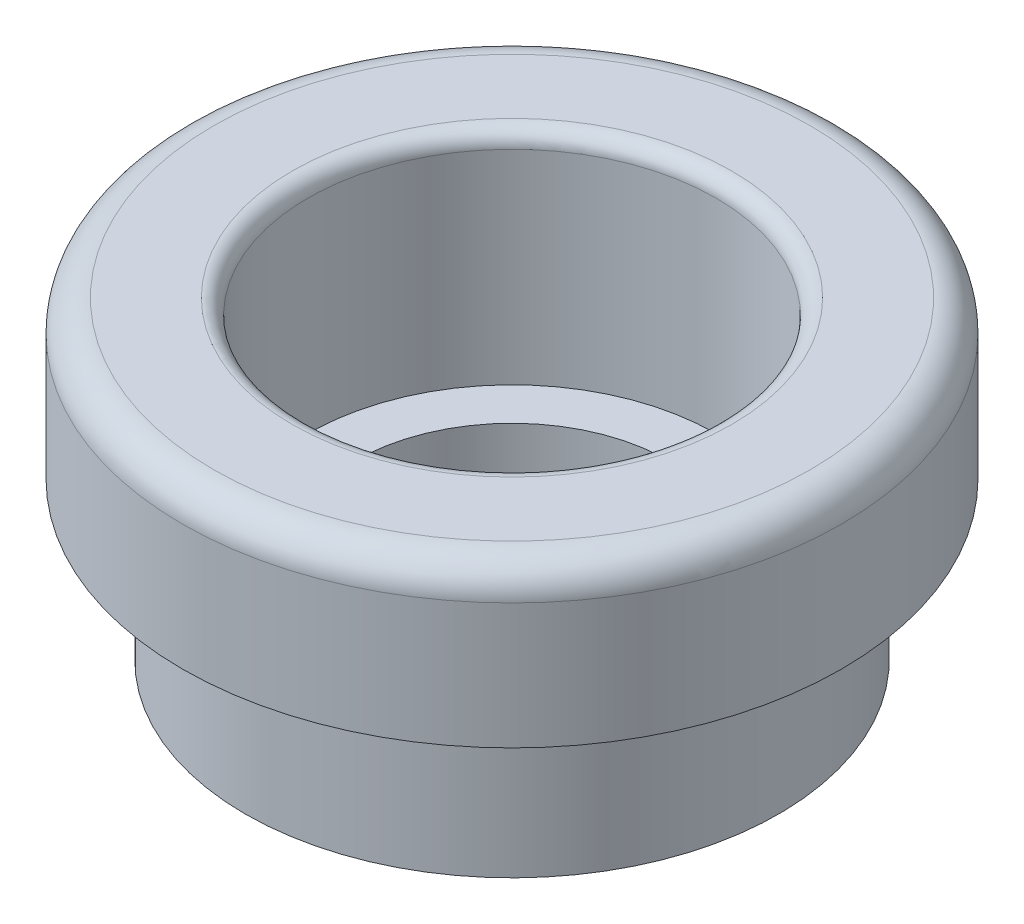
SolidWorks part; units mm, degrees
ref_plane "Front Plane" through (0, 0, 0) normal (0, 0, 1) x (1, 0, 0)
ref_plane "Top Plane" through (0, 0, 0) normal (0, 1, 0) x (1, 0, 0)
ref_plane "Right Plane" through (0, 0, 0) normal (1, 0, 0) x (0, 0, -1)
sketch "Sketch1" plane through (0, 0, 0) normal (0, 1, 0) x (1, 0, 0)
  circle A0 centre (0, 0) radius 8.5
  dimension "D1" = 17
extrude "Boss-Extrude1" add sketch "Sketch1" along normal blind 5
sketch "Sketch2" plane through (0, 5, 0) normal (0, 1, 0) x (1, 0, 0)
  circle A0 centre (0, 0) radius 10.5
  dimension "D1" = 21
extrude "Boss-Extrude2" add sketch "Sketch2" along normal blind 5
sketch "Sketch3" plane through (0, 10, 0) normal (0, 1, 0) x (1, 0, 0)
  circle A0 centre (0, 0) radius 5
  dimension "D1" = 10
extrude "Cut-Extrude1" cut sketch "Sketch3" against normal through all
sketch "Sketch4" plane through (0, 10, 0) normal (0, 1, 0) x (1, 0, 0)
  circle A0 centre (0, 0) radius 6.5
  dimension "D1" = 13
extrude "Cut-Extrude2" cut sketch "Sketch4" against normal blind 7
fillet "Fillet1" radius 1 1 edges at (0, 10, 10.5)
fillet "Fillet2" radius 0.5 1 edges at (0, 10, 6.5)
